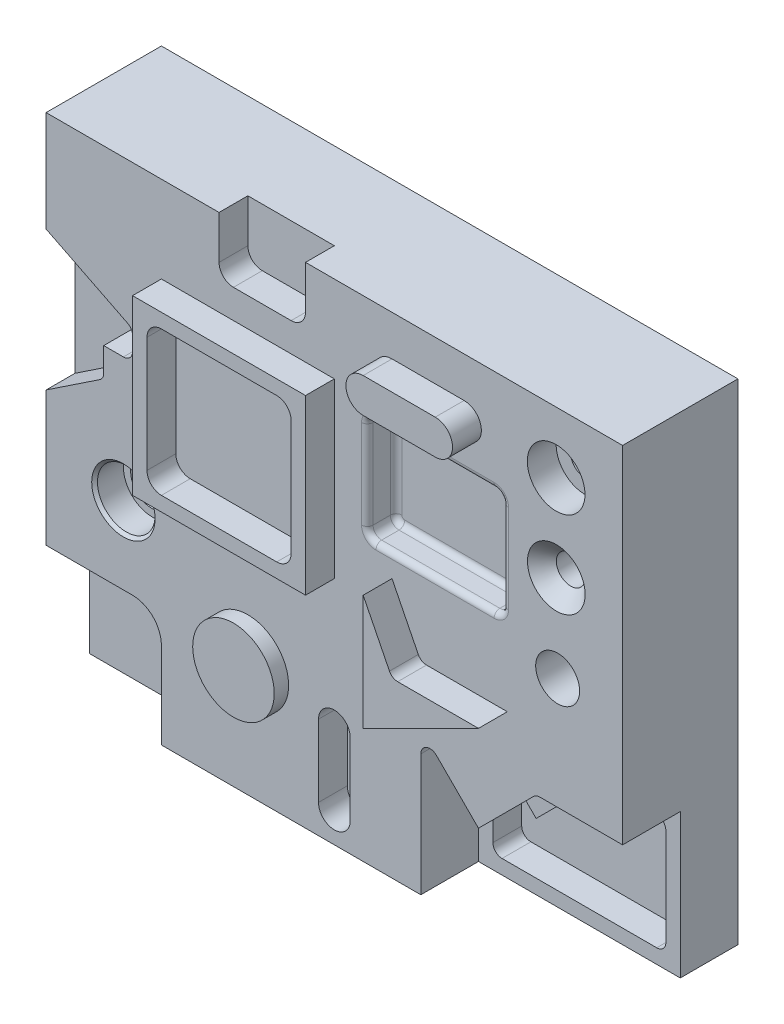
SolidWorks part; units mm, degrees
ref_plane "Plane1" through (0, 0, 0) normal (0, 0, 1) x (1, 0, 0)
ref_plane "Plane2" through (0, 0, 0) normal (0, 1, 0) x (1, 0, 0)
ref_plane "Plane3" through (0, 0, 0) normal (1, 0, 0) x (0, 0, -1)
imported_body "Imported1"
sketch "Sketch1" plane through (0, 0, 40) normal (0, 0, 1) x (1, 0, 0)
  circle A0 centre (77, 38.7257) radius 5
  circle A2 centre (76.9434, 68.7257) radius 10 construction
  dimension "D1" = 10
  dimension "D2" = 30
extrude "Cut-Extrude1" cut sketch "Sketch1" against normal blind 30
sketch "Sketch2" plane through (0, 0, 40) normal (0, 0, 1) x (1, 0, 0)
  circle A0 centre (77.47, 8.7257) radius 7.62
  circle A1 centre (77, 38.7257) radius 5 construction
  dimension "D1" = 30
extrude "Cut-Extrude2" cut sketch "Sketch2" against normal blind 40
chamfer "Chamfer1" distance 5 angle 45 1 edges at (82, 38.7257, 40)
sketch "Sketch3" plane through (0, 0, 40) normal (0, 0, 1) x (1, 0, 0)
  line L1 (14.43, 54.61) -> (55.42, 54.61)
  line L2 (11.43, 51.61) -> (11.43, 20.78)
  line L3 (14.43, 17.78) -> (55.42, 17.78)
  line L4 (58.42, 51.61) -> (58.42, 20.78)
  arc A0 (11.43, 51.61) -> (14.43, 54.61) centre (14.43, 51.61) cw
  arc A1 (14.43, 17.78) -> (11.43, 20.78) centre (14.43, 20.78) cw
  arc A2 (58.42, 20.78) -> (55.42, 17.78) centre (55.42, 20.78) cw
  arc A3 (58.42, 51.61) -> (55.42, 54.61) centre (55.42, 51.61) ccw
  dimension "D1" = 3
extrude "Cut-Extrude3" cut sketch "Sketch3" against normal blind 10
fillet "Fillet2" radius 2 16 edges at (12.3087, 53.7313, 30) (34.925, 54.61, 30) (57.5413, 53.7313, 30) (58.42, 36.195, 30) (57.5413, 18.6587, 30) (34.925, 17.78, 30) (12.3087, 18.6587, 30) (11.43, 36.195, 30) (12.3087, 53.7313, 40) (11.43, 36.195, 40) (12.3087, 18.6587, 40) (34.925, 17.78, 40) (57.5413, 18.6587, 40) (58.42, 36.195, 40) (57.5413, 53.7313, 40) (34.925, 54.61, 40)
